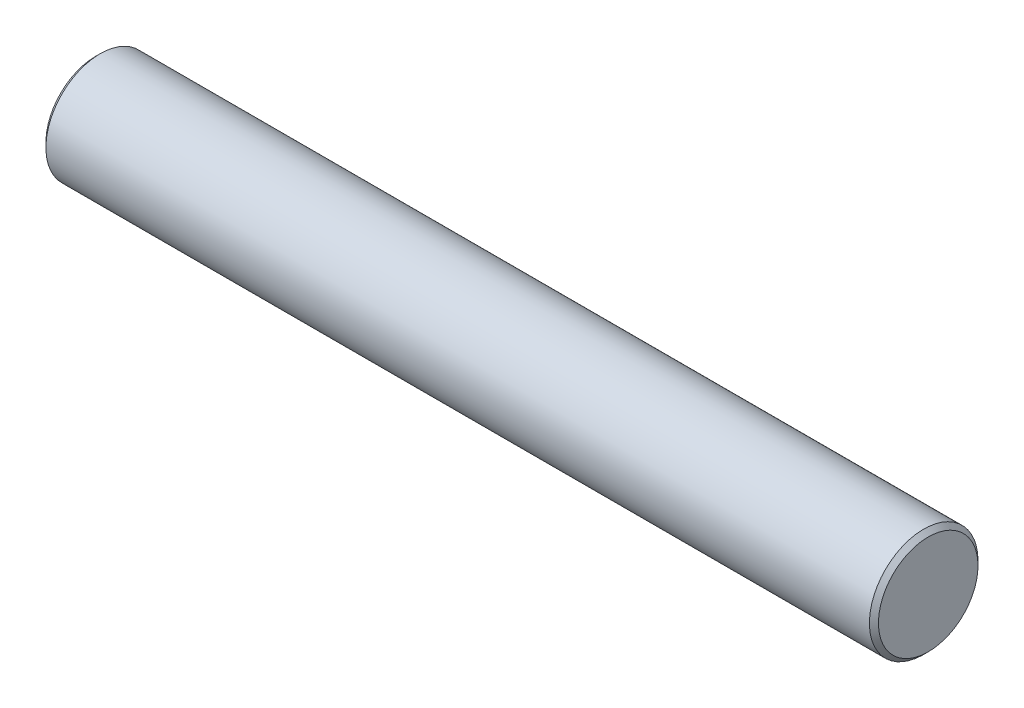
SolidWorks part; units mm, degrees
ref_plane "Спереди" through (0, 0, 0) normal (0, 0, 1) x (1, 0, 0)
ref_plane "Сверху" through (0, 0, 0) normal (0, 1, 0) x (1, 0, 0)
ref_plane "Справа" through (0, 0, 0) normal (1, 0, 0) x (0, 0, -1)
sketch "Эскиз1" plane through (0, 0, 0) normal (1, 0, 0) x (0, 0, -1)
  circle A0 centre (0, 0) radius 3
  dimension "D1" = 6
extrude "Бобышка-Вытянуть1" add sketch "Эскиз1" along normal blind 46
chamfer "Фаска1" distance 0.25 angle 45 2 edges at (0, 0, -3) (46, 0, -3)
